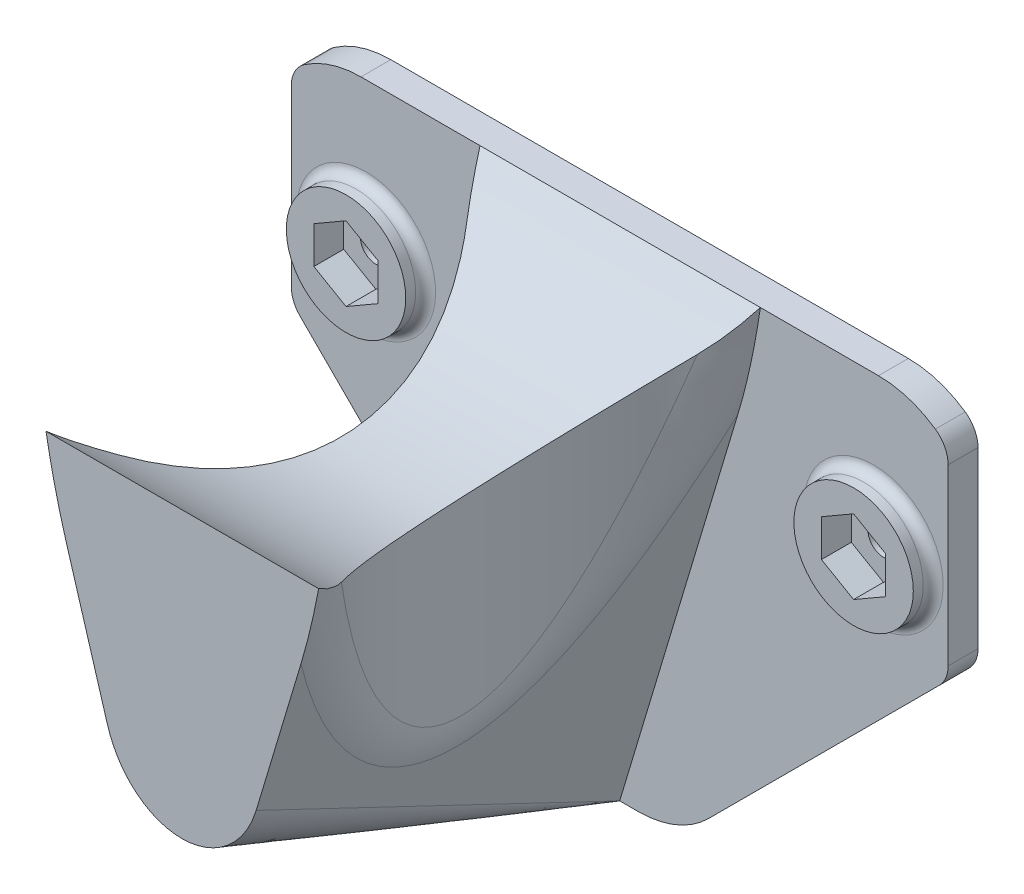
SolidWorks part; units mm, degrees
ref_plane "Front Plane" through (0, 0, 0) normal (0, 0, 1) x (1, 0, 0)
ref_plane "Top Plane" through (0, 0, 0) normal (0, 1, 0) x (1, 0, 0)
ref_plane "Right Plane" through (0, 0, 0) normal (1, 0, 0) x (0, 0, -1)
body saved out of another part "Stock-GPS Mount-1"
